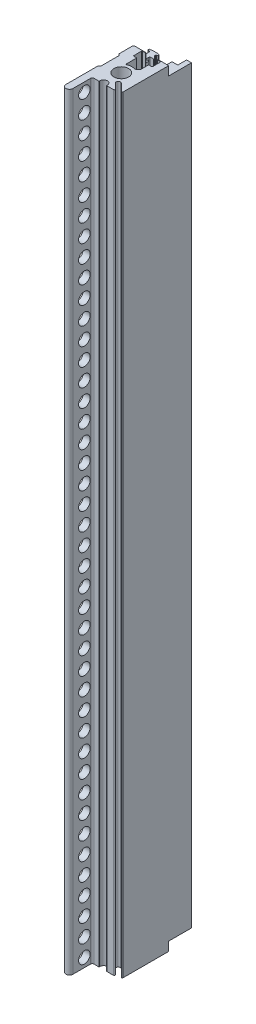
SolidWorks part; units mm, degrees
ref_plane "前视基准面" through (0, 0, 0) normal (0, 0, 1) x (1, 0, 0)
ref_plane "上视基准面" through (0, 0, 0) normal (0, 1, 0) x (1, 0, 0)
ref_plane "右视基准面" through (0, 0, 0) normal (1, 0, 0) x (0, 0, -1)
sketch "草图1" plane through (0, 0, 0) normal (0, 1, 0) x (1, 0, 0)
  line L0 (-4.2, 11.9) -> (-3.9, 11.9)
  line L1 (-4.4, 12.2) -> (-4.4, 12.1)
  line L2 (-4.0328, 12.4) -> (-4.2, 12.4)
  line L3 (-3.85, 12.5) -> (-3.8914, 12.4586)
  line L4 (-2.05, 12.5) -> (-3.85, 12.5)
  line L5 (-2.0086, 12.4586) -> (-2.05, 12.5)
  line L6 (-1.7, 12.4) -> (-1.8672, 12.4)
  line L7 (-1.5, 12.1) -> (-1.5, 12.2)
  line L8 (-1.8, 11.9) -> (-1.7, 11.9)
  line L9 (-2, 11.4828) -> (-2, 11.7)
  line L10 (-1.3586, 10.7586) -> (-1.9414, 11.3414)
  line L11 (-1.3, 10.55) -> (-1.3, 10.6172)
  line L12 (-3.7, 11.7) -> (-3.7, 9.95)
  line L13 (-5, -10.75) -> (-5, -1.6)
  line L14 (-3, -10.75) -> (-3, -5.75)
  line L15 (-2.5, -5.25) -> (-1.15, -5.25)
  line L16 (1.6887, -3.3855) -> (3.2118, -4.9086)
  line L17 (2.5373, -2.537) -> (4.6586, -4.6583)
  line L18 (5, 15) -> (5, 5.1793)
  line L19 (3.6, 15) -> (5, 15)
  line L20 (3.6, 12.5) -> (3.6, 15)
  line L21 (1.95, 12.5) -> (3.6, 12.5)
  line L22 (1.95, 10.55) -> (1.95, 12.5)
  line L23 (2.85, 10.55) -> (1.95, 10.55)
  line L24 (2.85, 9.35) -> (2.85, 10.55)
  line L25 (1.95, 9.35) -> (2.85, 9.35)
  line L26 (1.95, 8.35) -> (1.95, 9.35)
  line L27 (2.85, 8.35) -> (1.95, 8.35)
  line L28 (2.85, 6.05) -> (2.85, 8.35)
  line L29 (1.95, 6.05) -> (2.85, 6.05)
  line L30 (1.95, 3.8856) -> (1.95, 6.05)
  line L31 (-1.45, 6.05) -> (-1.45, 2.9458)
  line L32 (-2.35, 6.05) -> (-1.45, 6.05)
  line L33 (-2.35, 8.35) -> (-2.35, 6.05)
  line L34 (-1.45, 8.35) -> (-2.35, 8.35)
  line L35 (-1.45, 9.35) -> (-1.45, 8.35)
  line L36 (-2.35, 9.35) -> (-1.45, 9.35)
  line L37 (-2.35, 10.55) -> (-2.35, 9.35)
  line L38 (-1.3, 10.55) -> (-2.35, 10.55)
  line L39 (-4.45, 7.7) -> (-4.7, 7.7) construction
  line L40 (-5, 7.4) -> (-4.7, 7.7) construction
  line L41 (-5, 4.4) -> (-5, 7.4)
  line L42 (-4.5499, 3.8998) -> (-5, 4.4)
  line L43 (-4.45, 8.5) -> (-4.45, 9.55)
  line L44 (-3.9, 9.75) -> (-4.25, 9.75)
  line L45 (-4.5499, 3.8998) -> (-4.5501, -1.1002)
  line L46 (-5, -1.6) -> (-4.5501, -1.1002)
  line L47 (4.9414, -1.9395) -> (4.2929, -1.291) construction
  line L48 (5, -2.081) -> (5, -4.5169)
  line L49 (0, 0) -> (0, -5) construction
  line L50 (4, -0.5839) -> (4, 3.6823) construction
  line L51 (-1.05, -5) -> (-1.05, -5.15)
  line L52 (1.05, -5) -> (1.05, -5.15)
  line L53 (1.15, -5.25) -> (3.0703, -5.25)
  line L54 (2.5373, -2.537) -> (1.6887, -3.3855) construction
  line L55 (5, 5.1793) -> (5, -2.081)
  line L56 (-4.45, 8.5) -> (-4.7, 8.5)
  line L57 (-4.7, 8.5) -> (-5, 8.2)
  line L58 (4.9414, 5.0379) -> (4.2929, 4.3894) construction
  line L59 (-5, 8.2) -> (-5, 7.4)
  circle A0 centre (0, 0) radius 1.6
  arc A1 (-4.4, 12.1) -> (-4.2, 11.9) centre (-4.2, 12.1) ccw
  arc A2 (-4.2, 12.4) -> (-4.4, 12.2) centre (-4.2, 12.2) ccw
  arc A3 (-4.0328, 12.4) -> (-3.8914, 12.4586) centre (-4.0328, 12.6) ccw
  arc A4 (-2.0086, 12.4586) -> (-1.8672, 12.4) centre (-1.8672, 12.6) ccw
  arc A5 (-1.5, 12.2) -> (-1.7, 12.4) centre (-1.7, 12.2) ccw
  arc A6 (-1.7, 11.9) -> (-1.5, 12.1) centre (-1.7, 12.1) ccw
  arc A7 (-1.8, 11.9) -> (-2, 11.7) centre (-1.8, 11.7) ccw
  arc A8 (-2, 11.4828) -> (-1.9414, 11.3414) centre (-1.8, 11.4828) ccw
  arc A9 (-1.3, 10.6172) -> (-1.3586, 10.7586) centre (-1.5, 10.6172) ccw
  arc A10 (-5, -10.75) -> (-3, -10.75) centre (-4, -10.75) ccw
  arc A11 (3.0703, -5.25) -> (3.2118, -4.9086) centre (3.0703, -5.05) ccw
  arc A12 (-4.25, 9.75) -> (-4.45, 9.55) centre (-4.25, 9.55) ccw
  arc A13 (-3.9, 9.75) -> (-3.7, 9.95) centre (-3.9, 9.95) ccw
  arc A14 (5, -2.081) -> (4.9414, -1.9395) centre (4.8, -2.081) ccw construction
  arc A15 (4.9414, 5.0379) -> (5, 5.1793) centre (4.8, 5.1793) ccw construction
  arc A16 (4.6586, -4.6583) -> (5, -4.5169) centre (4.8, -4.5169) ccw
  arc A17 (2.5373, -2.537) -> (1.6887, -3.3855) centre (2.113, -2.9613) ccw
  arc A18 (0.7125, 2.9142) -> (-1.1719, 2.7616) centre (0, 0) ccw
  arc A19 (-1.45, 2.9458) -> (-1.1719, 2.7616) centre (-1.25, 2.9458) ccw
  arc A20 (0.7125, 2.9142) -> (1.95, 3.8856) centre (0.95, 3.8856) ccw
  arc A21 (-3.7, 11.7) -> (-3.9, 11.9) centre (-3.9, 11.7) ccw
  arc A22 (4.2929, -1.291) -> (4, -0.5839) centre (5, -0.5839) cw construction
  arc A23 (4, 3.6823) -> (4.2929, 4.3894) centre (5, 3.6823) cw construction
  arc A24 (1.05, -5) -> (-1.05, -5) centre (0, -5) ccw
  arc A25 (1.15, -5.25) -> (1.05, -5.15) centre (1.15, -5.15) cw
  arc A26 (-1.05, -5.15) -> (-1.15, -5.25) centre (-1.15, -5.15) cw
  arc A29 (-3, -5.75) -> (-2.5, -5.25) centre (-2.5, -5.75) cw
  point P104 (1.05, -5.25)
  dimension "D1" = 3.2
  dimension "D2" = 2.1
  dimension "D3" = 5.2
  dimension "D4" = 45
  dimension "D5" = 1.2
  dimension "D7" = 0.6
  dimension "D8" = 0.2
  dimension "D10" = 5
  dimension "D11" = 0.1
  dimension "D12" = 0.25
  dimension "D6" = 3
  dimension "D9" = 2.1225
  dimension "D13" = 0.8
extrude "凸台-拉伸1" add sketch "草图1" along normal mid plane 218.44
sketch "草图7" plane through (0, 109.22, 0) normal (0, 1, 0) x (1, 0, 0)
  line L0 (1.95, 8.35) -> (2.85, 8.35) construction
  line L1 (2.95, 8.35) -> (-2.45, 8.35)
  line L2 (2.95, 8.35) -> (2.95, 5.85)
  line L3 (2.95, 5.85) -> (-2.45, 5.85)
  line L4 (-2.45, 8.35) -> (-2.45, 5.85)
  line L5 (1.95, 10.55) -> (2.85, 10.55) construction
  line L6 (2.95, 10.55) -> (-2.45, 10.55)
  line L7 (2.95, 10.55) -> (2.95, 9.35)
  line L8 (2.95, 9.35) -> (-2.45, 9.35)
  line L9 (-2.45, 10.55) -> (-2.45, 9.35)
  line L10 (-1.45, 9.35) -> (-2.35, 9.35) construction
  line L11 (2.85, 8.35) -> (2.85, 6.05) construction
  line L12 (-2.35, 6.05) -> (-2.35, 8.35) construction
  line L13 (-1.45, 6.05) -> (-2.35, 6.05) construction
  dimension "D1" = 0.1
  dimension "D2" = 0.1
  dimension "D3" = 0.2
extrude "切除-拉伸6" cut sketch "草图7" against normal through all
fillet "圆角1" radius 0.2 8 edges at (2.95, 0, -5.85) (2.95, 0, -8.35) (-2.45, 0, -5.85) (-2.45, 0, -8.35) (-2.45, 0, -9.35) (-2.45, 0, -10.55) (2.95, 0, -9.35) (2.95, 0, -10.55)
sketch "草图2" plane through (0, 109.22, 0) normal (0, 1, 0) x (1, 0, 0)
  circle A0 centre (0, 0) radius 2.1
  dimension "D1" = 4.2
extrude "切除-拉伸1" cut sketch "草图2" against normal blind 10
sketch "草图3" plane through (0, -109.22, 0) normal (0, -1, 0) x (1, 0, 0)
  circle A0 centre (0, 0) radius 2.1
  dimension "D1" = 4.2
extrude "切除-拉伸2" cut sketch "草图3" against normal blind 10
sketch "草图4" plane through (-5, 0, 0) normal (-1, 0, 0) x (0, 0, 1)
  line L0 (1.6, -109.22) -> (10.75, -109.22) construction
  line L1 (11.75, -109.22) -> (11.75, 109.22) construction
  circle A0 centre (7.5, -106.68) radius 1.65
  circle A1 centre (7.5, -101.6) radius 1.65
  circle A2 centre (7.5, -96.52) radius 1.65
  circle A3 centre (7.5, -91.44) radius 1.65
  circle A4 centre (7.5, -86.36) radius 1.65
  circle A5 centre (7.5, -81.28) radius 1.65
  circle A6 centre (7.5, -76.2) radius 1.65
  circle A7 centre (7.5, -71.12) radius 1.65
  circle A8 centre (7.5, -66.04) radius 1.65
  circle A9 centre (7.5, -60.96) radius 1.65
  circle A10 centre (7.5, -55.88) radius 1.65
  circle A11 centre (7.5, -50.8) radius 1.65
  circle A12 centre (7.5, -45.72) radius 1.65
  circle A13 centre (7.5, -40.64) radius 1.65
  circle A14 centre (7.5, -35.56) radius 1.65
  circle A15 centre (7.5, -30.48) radius 1.65
  circle A16 centre (7.5, -25.4) radius 1.65
  circle A17 centre (7.5, -20.32) radius 1.65
  circle A18 centre (7.5, -15.24) radius 1.65
  circle A19 centre (7.5, -10.16) radius 1.65
  circle A20 centre (7.5, -5.08) radius 1.65
  circle A21 centre (7.5, 0) radius 1.65
  circle A22 centre (7.5, 5.08) radius 1.65
  circle A23 centre (7.5, 10.16) radius 1.65
  circle A24 centre (7.5, 15.24) radius 1.65
  circle A25 centre (7.5, 20.32) radius 1.65
  circle A26 centre (7.5, 25.4) radius 1.65
  circle A27 centre (7.5, 30.48) radius 1.65
  circle A28 centre (7.5, 35.56) radius 1.65
  circle A29 centre (7.5, 40.64) radius 1.65
  circle A30 centre (7.5, 45.72) radius 1.65
  circle A31 centre (7.5, 50.8) radius 1.65
  circle A32 centre (7.5, 55.88) radius 1.65
  circle A33 centre (7.5, 60.96) radius 1.65
  circle A34 centre (7.5, 66.04) radius 1.65
  circle A35 centre (7.5, 71.12) radius 1.65
  circle A36 centre (7.5, 76.2) radius 1.65
  circle A37 centre (7.5, 81.28) radius 1.65
  circle A38 centre (7.5, 86.36) radius 1.65
  circle A39 centre (7.5, 91.44) radius 1.65
  circle A40 centre (7.5, 96.52) radius 1.65
  circle A41 centre (7.5, 101.6) radius 1.65
  circle A42 centre (7.5, 106.68) radius 1.65
  circle A43 centre (7.5, 111.76) radius 1.65
  circle A44 centre (7.5, 116.84) radius 1.65
  circle A45 centre (7.5, 121.92) radius 1.65
  circle A46 centre (7.5, 127) radius 1.65
  circle A47 centre (7.5, 132.08) radius 1.65
  circle A48 centre (7.5, 137.16) radius 1.65
  circle A49 centre (7.5, 142.24) radius 1.65
  circle A50 centre (7.5, 147.32) radius 1.65
  circle A51 centre (7.5, 152.4) radius 1.65
  circle A52 centre (7.5, 157.48) radius 1.65
  circle A53 centre (7.5, 162.56) radius 1.65
  circle A54 centre (7.5, 167.64) radius 1.65
  circle A55 centre (7.5, 172.72) radius 1.65
  circle A56 centre (7.5, 177.8) radius 1.65
  circle A57 centre (7.5, 182.88) radius 1.65
  circle A58 centre (7.5, 187.96) radius 1.65
  circle A59 centre (7.5, 193.04) radius 1.65
  circle A60 centre (7.5, 198.12) radius 1.65
  circle A61 centre (7.5, 203.2) radius 1.65
  circle A62 centre (7.5, 208.28) radius 1.65
  circle A63 centre (7.5, 213.36) radius 1.65
  circle A64 centre (7.5, 218.44) radius 1.65
  circle A65 centre (7.5, 223.52) radius 1.65
  circle A66 centre (7.5, 228.6) radius 1.65
  circle A67 centre (7.5, 233.68) radius 1.65
  circle A68 centre (7.5, 238.76) radius 1.65
  circle A69 centre (7.5, 243.84) radius 1.65
  circle A70 centre (7.5, 248.92) radius 1.65
  circle A71 centre (7.5, 254) radius 1.65
  circle A72 centre (7.5, 259.08) radius 1.65
  circle A73 centre (7.5, 264.16) radius 1.65
  circle A74 centre (7.5, 269.24) radius 1.65
  circle A75 centre (7.5, 274.32) radius 1.65
  circle A76 centre (7.5, 279.4) radius 1.65
  circle A77 centre (7.5, 284.48) radius 1.65
  circle A78 centre (7.5, 289.56) radius 1.65
  circle A79 centre (7.5, 294.64) radius 1.65
  circle A80 centre (7.5, 299.72) radius 1.65
  circle A81 centre (7.5, 304.8) radius 1.65
  circle A82 centre (7.5, 309.88) radius 1.65
  circle A83 centre (7.5, 314.96) radius 1.65
  circle A84 centre (7.5, 320.04) radius 1.65
  dimension "D1" = 2.54
  dimension "D2" = 4.25
  dimension "D3" = 3.3
  dimension "D5" = 5.08
  dimension "D4" = 85
extrude "切除-拉伸3" cut sketch "草图4" against normal blind 12
sketch "草图5" plane through (5, 0, 0) normal (1, 0, 0) x (0, 0, -1)
  line L0 (15, 0) -> (41.1348, 0) construction
  line L1 (15, 109.22) -> (8.5, 109.22)
  line L2 (15, 109.22) -> (15, 106.68)
  line L3 (15, 106.68) -> (8.5, 106.68)
  line L4 (8.5, 109.22) -> (8.5, 106.68)
  line L5 (15, 109.22) -> (15, -109.22) construction
  line L6 (8.5, -109.22) -> (8.5, -106.68)
  line L7 (15, -106.68) -> (8.5, -106.68)
  line L8 (15, -109.22) -> (15, -106.68)
  line L9 (15, -109.22) -> (8.5, -109.22)
  dimension "D1" = 6.5
  dimension "D2" = 2.54
extrude "切除-拉伸4" cut sketch "草图5" against normal blind 10
